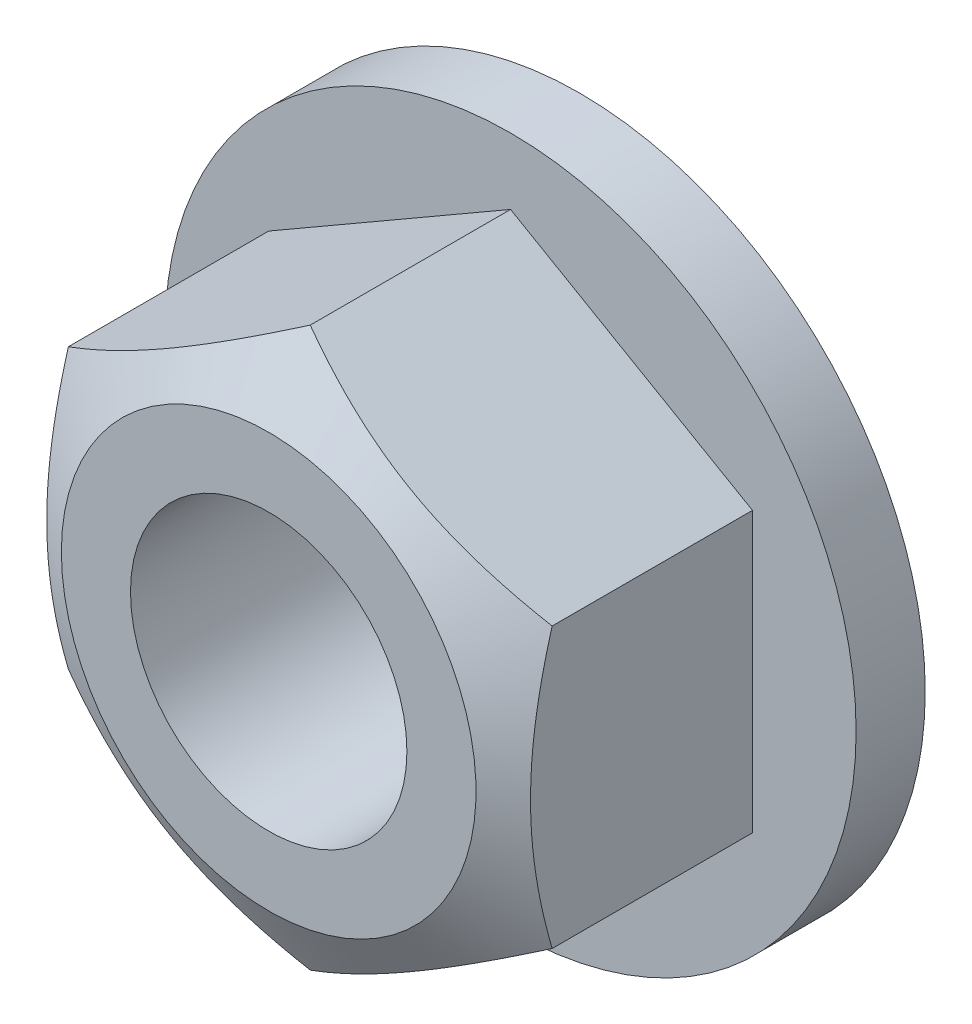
SolidWorks part; units mm, degrees
ref_plane "正面" through (0, 0, 0) normal (0, 0, 1) x (1, 0, 0)
ref_plane "平面" through (0, 0, 0) normal (0, 1, 0) x (1, 0, 0)
ref_plane "右側面" through (0, 0, 0) normal (1, 0, 0) x (0, 0, -1)
sketch "ｽｹｯﾁ1" plane through (0, 0, 0) normal (0, 0, 1) x (1, 0, 0)
  line L1 (0, 4.0415) -> (-3.5, 2.0207)
  line L2 (-3.5, 2.0207) -> (-3.5, -2.0207)
  line L3 (-3.5, -2.0207) -> (0, -4.0415)
  line L4 (0, -4.0415) -> (3.5, -2.0207)
  line L5 (3.5, -2.0207) -> (3.5, 2.0207)
  line L6 (3.5, 2.0207) -> (0, 4.0415)
  circle A0 centre (0, 0) radius 3.5 construction
  dimension "D1" = 7
extrude "押し出し1" add sketch "ｽｹｯﾁ1" along normal blind 4.5
sketch "ｽｹｯﾁ2" plane through (0, 0, 0) normal (0, 0, 1) x (1, 0, 0)
  circle A0 centre (0, 0) radius 5
  dimension "D1" = 10
extrude "押し出し2" add sketch "ｽｹｯﾁ2" along normal blind 1
sketch "ｽｹｯﾁ3" plane through (0, 0, 0) normal (1, 0, 0) x (0, 0, -1)
  line L0 (0, 0) -> (-6.3435, 0) construction
  line L1 (-3.0015, 5.5956) -> (-4.5, 3)
  line L2 (-4.5, 2.0207) -> (-4.5, 4.0415) construction
  dimension "D1" = 30
  dimension "D2" = 6
other "ｶｯﾄ-回転-薄板1" parameters "D1"=360, "D3"=1, "D4"=1
sketch "ｽｹｯﾁ4" plane through (0, 0, 0) normal (0, 0, 1) x (1, 0, 0)
  circle A0 centre (0, 0) radius 2
  dimension "D1" = 4
extrude "押し出し3" cut sketch "ｽｹｯﾁ4" along normal through all
